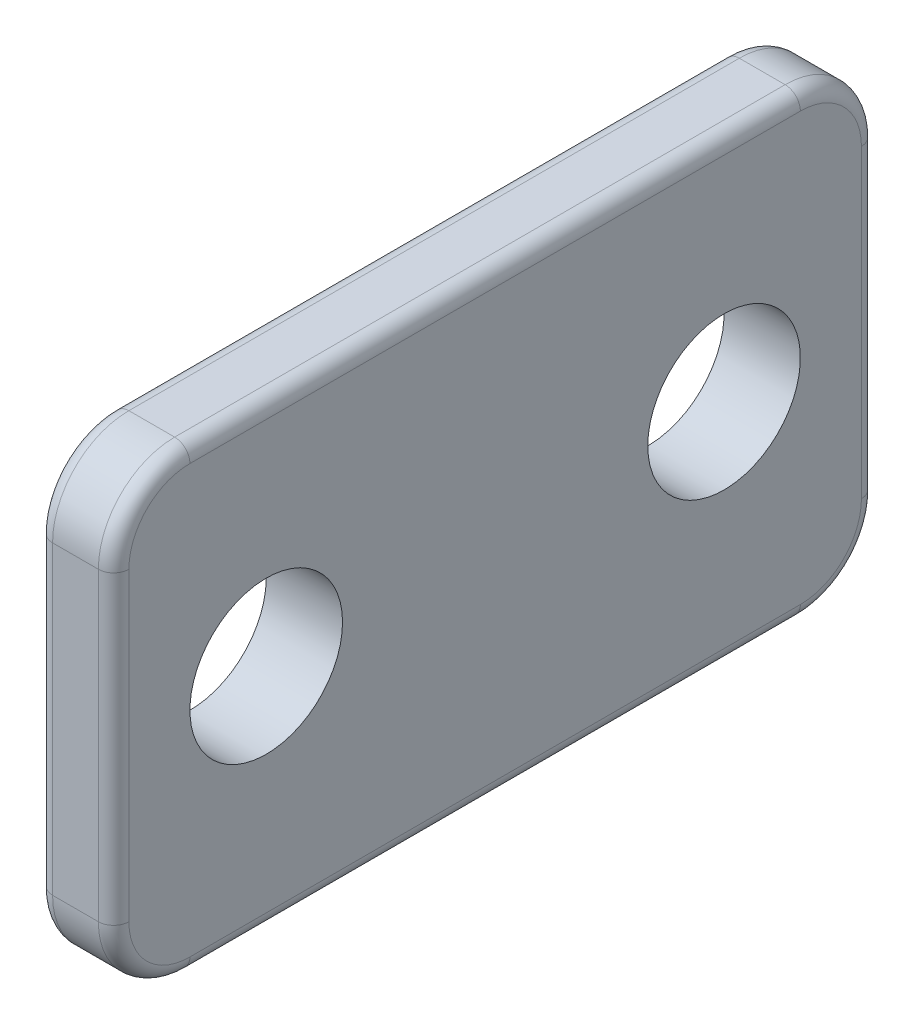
SolidWorks part; units mm, degrees
other "<Door Block Bracket_02>-<Fillet1>"
ref_plane "Front Plane" through (0, 0, 0) normal (0, 0, 1) x (1, 0, 0)
ref_plane "Top Plane" through (0, 0, 0) normal (0, 1, 0) x (1, 0, 0)
ref_plane "Right Plane" through (0, 0, 0) normal (1, 0, 0) x (0, 0, -1)
mirrored part "Door Block Bracket_02_Mirrored"
